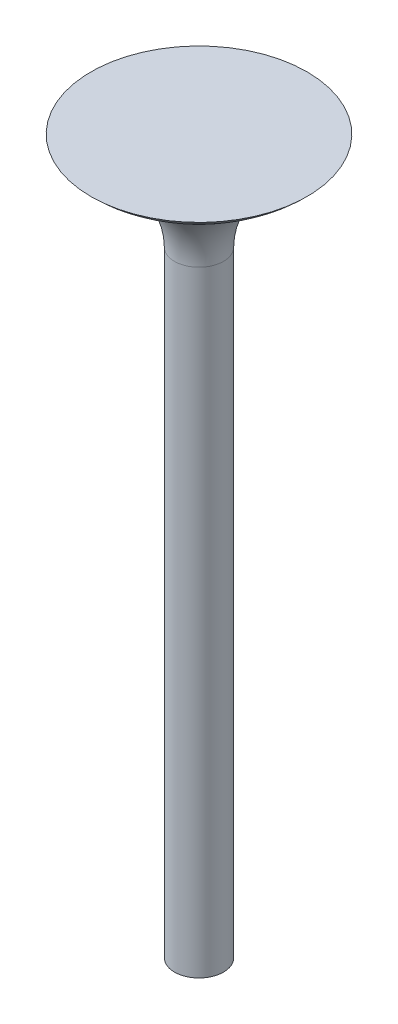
SolidWorks part; units mm, degrees
ref_plane "Front Plane" through (0, 0, 0) normal (0, 0, 1) x (1, 0, 0)
ref_plane "Top Plane" through (0, 0, 0) normal (0, 1, 0) x (1, 0, 0)
ref_plane "Right Plane" through (0, 0, 0) normal (1, 0, 0) x (0, 0, -1)
sketch "Sketch1" plane through (0, 0, 0) normal (0, 1, 0) x (1, 0, 0)
  circle A0 centre (0, 0) radius 3.5
  dimension "D1" = 7
extrude "Boss-Extrude1" add sketch "Sketch1" along normal blind 100
sketch "Sketch2" plane through (0, 100, 0) normal (0, 1, 0) x (1, 0, 0)
  circle A0 centre (0, 0) radius 15.45
  dimension "D1" = 30.9
extrude "Boss-Extrude2" add sketch "Sketch2" along normal blind 2
fillet "Fillet1" radius 12 1 edges at (0, 100, 3.5)
fillet "Fillet2" radius 12 1 edges at (0, 100, 15.45)
